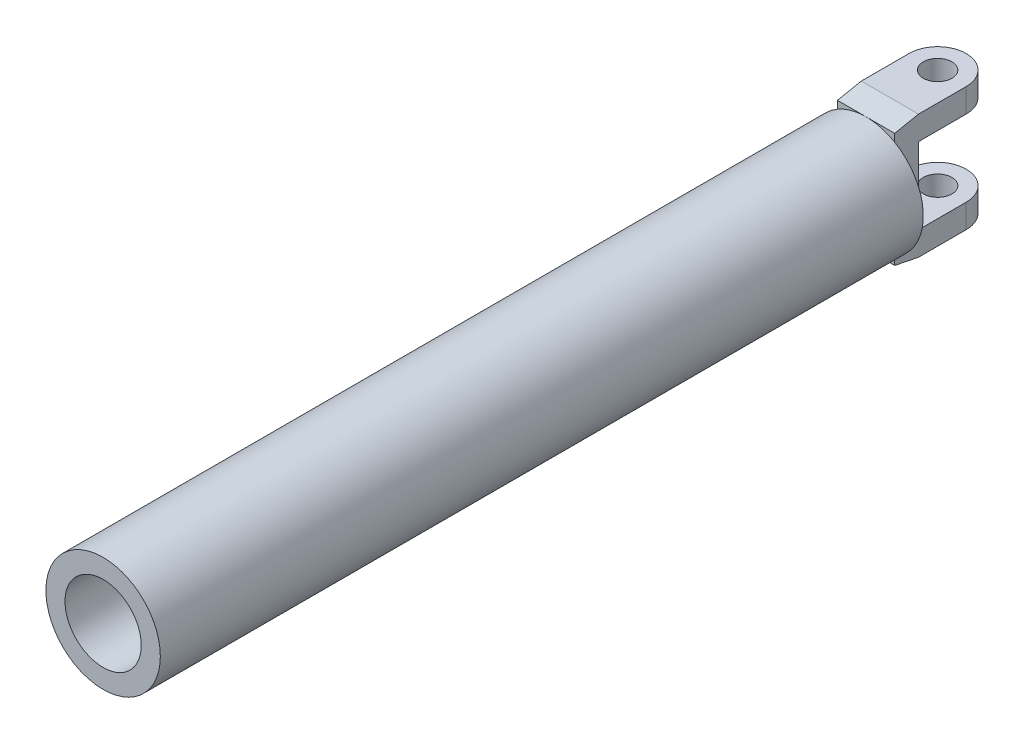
SolidWorks part; units mm, degrees
ref_plane "Front Plane" through (0, 0, 0) normal (0, 0, 1) x (1, 0, 0)
ref_plane "Top Plane" through (0, 0, 0) normal (0, 1, 0) x (1, 0, 0)
ref_plane "Right Plane" through (0, 0, 0) normal (1, 0, 0) x (0, 0, -1)
sketch "Sketch1" plane through (0, 0, 0) normal (0, 0, 1) x (1, 0, 0)
  circle A0 centre (0, 0) radius 60
  dimension "D1" = 120
extrude "Boss-Extrude1" add sketch "Sketch1" along normal blind 800
sketch "Sketch2" plane through (0, 0, 0) normal (1, 0, 0) x (0, 0, -1)
  line L0 (0, -60) -> (0, 60)
  line L1 (0, -60) -> (0, 60) construction
  line L2 (0, 60) -> (25, 65)
  line L3 (25, 65) -> (105, 65)
  line L4 (105, 65) -> (105, 40)
  line L5 (105, 40) -> (27.4755, 40)
  line L6 (27.4755, 40) -> (25, 39.5049)
  line L7 (25, 39.5049) -> (25, -39.5049)
  line L8 (0, 0) -> (25, 0) construction
  line L9 (27.4755, -40) -> (25, -39.5049)
  line L10 (105, -40) -> (27.4755, -40)
  line L11 (105, -65) -> (105, -40)
  line L12 (25, -65) -> (105, -65)
  line L13 (0, -60) -> (25, -65)
  dimension "D1" = 25
  dimension "D2" = 25
  dimension "D3" = 25
  dimension "D4" = 40
  dimension "D5" = 105
  dimension "D6" = 80
extrude "Boss-Extrude2" add sketch "Sketch2" along normal mid plane 60
sketch "Sketch3" plane through (0, 0, 0) normal (0, 1, 0) x (1, 0, 0)
  line L0 (-30, 75) -> (30, 75) construction
  line L3 (30, 105) -> (-30, 105) construction
  line L4 (-30, 105) -> (-30, 25) construction
  line L5 (30, 105) -> (30, 25) construction
  circle A0 centre (0, 75) radius 15
  point P4 (-30, 75)
  point P9 (30, 75)
  dimension "D1" = 30
  dimension "D2" = 30
extrude "Cut-Extrude1" cut sketch "Sketch3" against normal through all both and the other way through all
fillet "Fillet1" radius 30 4 edges at (-30, -52.5, -105) (30, -52.5, -105) (-30, 52.5, -105) (30, 52.5, -105)
sketch "Sketch4" plane through (0, 0, 800) normal (0, 0, 1) x (1, 0, 0)
  circle A0 centre (0, 0) radius 40
  dimension "D1" = 80
extrude "Cut-Extrude2" cut sketch "Sketch4" against normal blind 500
